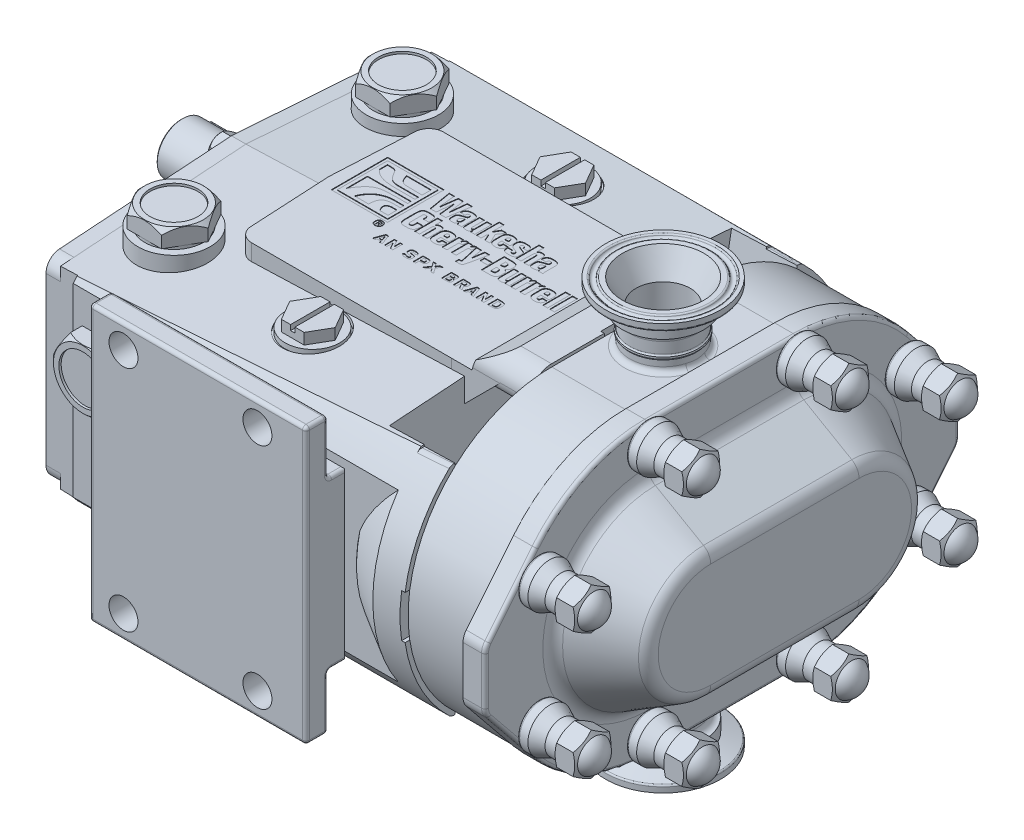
SolidWorks part; units mm, degrees
ref_plane "Front Plane" through (0, 0, 0) normal (0, 0, 1) x (1, 0, 0)
ref_plane "Top Plane" through (0, 0, 0) normal (0, 1, 0) x (1, 0, 0)
ref_plane "Right Plane" through (0, 0, 0) normal (1, 0, 0) x (0, 0, -1)
other "Join1"
other "cleanout plug<2>@006_015_U2_Upper Shaft"
other "grease fitting<7>@006_015_U2_Upper Shaft"
other "grease fitting<3>@006_015_U2_Upper Shaft"
other "cleanout plug<1>@006_015_U2_Upper Shaft"
other "grease fitting<6>@006_015_U2_Upper Shaft"
other "grease fitting<1>@006_015_U2_Upper Shaft"
other "oil plug<6>@006_015_U2_Upper Shaft"
other "oil plug<5>@006_015_U2_Upper Shaft"
other "oil plug<4>@006_015_U2_Upper Shaft"
other "oil plug<3>@006_015_U2_Upper Shaft"
other "oil plug<2>@006_015_U2_Upper Shaft"
other "Key<1>@006_015_U2_Upper Shaft"
other "Shaft<1>@006_015_U2_Upper Shaft"
other "oil plug<1>@006_015_U2_Upper Shaft"
other "108369<8>@006_015_U2_Upper Shaft"
other "108369<7>@006_015_U2_Upper Shaft"
other "108369<6>@006_015_U2_Upper Shaft"
other "108369<5>@006_015_U2_Upper Shaft"
other "108369<4>@006_015_U2_Upper Shaft"
other "108369<3>@006_015_U2_Upper Shaft"
other "108369<2>@006_015_U2_Upper Shaft"
other "108369<1>@006_015_U2_Upper Shaft"
other "101842<1>@006_015_U2_Upper Shaft"
other "015001000S<1>@006_015_U2_Upper Shaft"
other "020110000<1>@006_015_U2_Upper Shaft"
other "plate<1>@006_015_U2_Upper Shaft"
other "102276<1>@006_015_U2_Upper Shaft"
other "015360005<2>@006_015_U2_Upper Shaft"
other "015360005<1>@006_015_U2_Upper Shaft"
